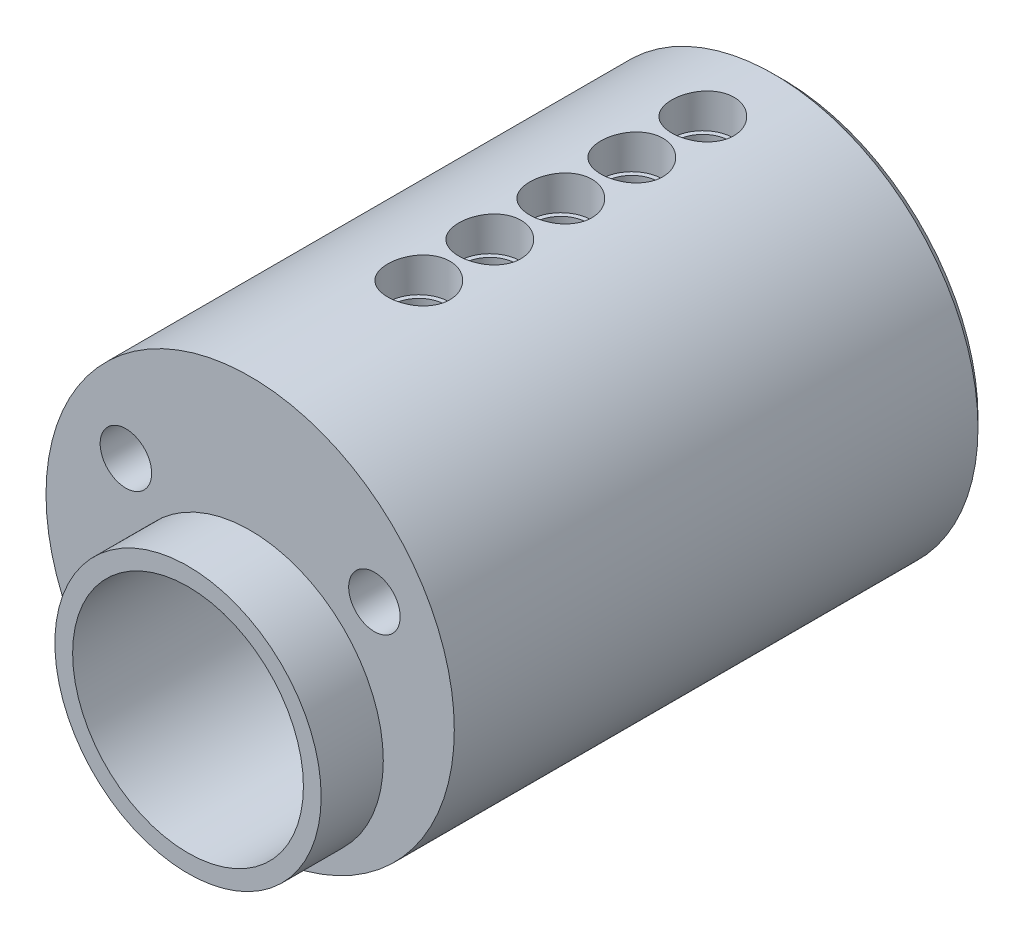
SolidWorks part; units mm, degrees
ref_plane "Plan de face" through (0, 0, 0) normal (0, 0, 1) x (1, 0, 0)
ref_plane "Plan de dessus" through (0, 0, 0) normal (0, 1, 0) x (1, 0, 0)
ref_plane "Plan de droite" through (0, 0, 0) normal (1, 0, 0) x (0, 0, -1)
sketch "Esquisse1" plane through (0, 0, 0) normal (0, 0, 1) x (1, 0, 0)
  circle A0 centre (0, 0) radius 11.5
  dimension "D1" = 23
extrude "Boss.-Extru.1" add sketch "Esquisse1" along normal blind 30
sketch "Esquisse2" plane through (0, 0, 0) normal (0, 0, -1) x (-1, 0, 0)
  line L0 (0, 0) -> (0, -3.5) construction
  circle A0 centre (0, -3.5) radius 6.5
  dimension "D2" = 13
  dimension "D1" = 3.5
extrude "Enlèv. mat.-Extru.1" cut sketch "Esquisse2" against normal through all
sketch "Esquisse3" plane through (0, 0, 0) normal (0, 0, -1) x (-1, 0, 0)
  circle A0 centre (0, -3.5) radius 7
  circle A1 centre (0, -3.5) radius 6.5 construction
  dimension "D1" = 14
extrude "Enlèv. mat.-Extru.2" cut sketch "Esquisse3" against normal blind 1
sketch "Esquisse4" plane through (0, 0, 30) normal (0, 0, 1) x (1, 0, 0)
  circle A0 centre (0, -3.5) radius 6.5 construction
  circle A1 centre (0, -3.5) radius 6.5
  circle A2 centre (0, -3.5) radius 7.5
  dimension "D1" = 15
extrude "Boss.-Extru.2" add sketch "Esquisse4" along normal blind 3.5
ref_plane "Plan1" through (0, 11.5, 0) normal (0, 1, 0) x (-1, 0, 0)
sketch "Esquisse7" plane through (0, 11.5, 0) normal (0, 1, 0) x (-1, 0, 0)
  line L0 (0, 0) -> (0, 26.7957) construction
  circle A0 centre (0, 4.5) radius 1.5
  circle A1 centre (0, 8.5) radius 1.5
  circle A2 centre (0, 12.5) radius 1.5
  circle A3 centre (0, 16.5) radius 1.5
  circle A4 centre (0, 20.5) radius 1.5
  dimension "D1" = 3
  dimension "D2" = 4.5
  dimension "D3" = 4
  dimension "D4" = 4
  dimension "D5" = 4
  dimension "D6" = 4
extrude "Enlèv. mat.-Extru.3" cut sketch "Esquisse7" against normal up to next
sketch "Esquisse8" plane through (0, 11.5, 0) normal (0, 1, 0) x (-1, 0, 0)
  circle A0 centre (0, 20.5) radius 1.75
  circle A1 centre (0, 16.5) radius 1.75
  circle A2 centre (0, 12.5) radius 1.75
  circle A3 centre (0, 8.5) radius 1.75
  circle A4 centre (0, 4.5) radius 1.75
  dimension "D1" = 3.5
extrude "Enlèv. mat.-Extru.4" cut sketch "Esquisse8" against normal blind 2
chamfer "Chanfrein1" distance 0.5 angle 45 1 edges at (11.5, 0, 0)
hole_wizard "Trou taraudé M3.5x0.61" positions "Esquisse10" profile "Esquisse9" tap size "M3.5x0.6" standard "Ansi Métrique"
sketch "Esquisse10" plane through (0, 0, 30) normal (0, 0, 1) x (1, 0, 0)
  line L0 (-7, 4) -> (7, 4) construction
  line L1 (0, 0) -> (0, 4) construction
  circle A1 centre (0, -3.5) radius 6.5 construction
  point P0 (-7, 4)
  point P1 (7, 4)
  point P13 (0, -3.5)
  dimension "D1" = 14
  dimension "D2" = 7.5
sketch "Esquisse9" plane through (-7, 4, 30) normal (1, 0, 0) x (0, -1, 0)
  line L0 (0, 0) -> (0, 10.8712)
  line L1 (0, 10.8712) -> (1.45, 10)
  line L2 (1.45, 10) -> (1.45, 0)
  line L5 (1.45, 0) -> (0, 0)
  line L10 (0, 10.8712) -> (-1.45, 10) construction
  line L11 (0, -6.35) -> (0, 107.95) construction
  dimension "Diamètre du trou pour taraudage" = 2.9
  dimension "Profondeur du trou pour taraudage" = 10
  dimension "Angle de pointe" = 118
sketch "Esquisse14" plane through (-8.1637, -2.2614, 0) normal (0, 0, -1) x (-1, 0, 0)
  line L0 (-2.9375, 5.4885) -> (-1.4063, 7.0198)
  line L1 (-8.1637, 2.2614) -> (-14.7844, 10.1516) construction
  line L2 (-8.1637, 2.2614) -> (-8.1637, 11.5) construction
  line L4 (-13.3899, 5.4885) -> (-14.9212, 7.0198)
  line L5 (-13.5667, 5.3117) -> (-15.0979, 6.843)
  line L6 (-2.7607, 5.3117) -> (-1.2295, 6.843)
  arc A0 (-1.543, 10.1516) -> (-14.7844, 10.1516) centre (-8.1637, 2.2614) ccw
  arc A3 (-4.1641, 5.3411) -> (-12.1634, 5.3411) centre (-8.1637, -1.2386) ccw
  arc A5 (-13.3899, 5.4885) -> (-12.1634, 5.3411) centre (-12.6828, 6.1956) ccw
  arc A6 (-14.7844, 10.1516) -> (-14.9212, 7.0198) centre (-13.4179, 8.523) ccw
  arc A7 (-2.9375, 5.4885) -> (-4.1641, 5.3411) centre (-3.6446, 6.1956) cw
  arc A8 (-1.543, 10.1516) -> (-1.4063, 7.0198) centre (-2.9096, 8.523) cw
  arc A9 (-1.3823, 10.3432) -> (-14.9451, 10.3432) centre (-8.1637, 2.2614) ccw
  arc A10 (-14.9451, 10.3432) -> (-15.0979, 6.843) centre (-13.4179, 8.523) ccw
  arc A11 (-13.5667, 5.3117) -> (-12.0335, 5.1275) centre (-12.6828, 6.1956) ccw
  arc A12 (-4.2939, 5.1275) -> (-12.0335, 5.1275) centre (-8.1637, -1.2386) ccw
  arc A13 (-2.7607, 5.3117) -> (-4.2939, 5.1275) centre (-3.6446, 6.1956) cw
  arc A14 (-1.3823, 10.3432) -> (-1.2295, 6.843) centre (-2.9096, 8.523) cw
  circle A15 centre (-8.1637, 2.2614) radius 11.5 construction
  circle A16 centre (-8.1637, 2.2614) radius 11 construction
  circle A17 centre (-8.1637, -1.2386) radius 7 construction
  dimension "D1" = 0.45
  dimension "D2" = 0.45
  dimension "D5" = 2.126
  dimension "D6" = 1
  dimension "D3" = 45
  dimension "D4" = 40
  dimension "D7" = 0.25
extrude "Enlèv. mat.-Extru.6" cut sketch "Esquisse14" against normal blind 0.01
sketch "Esquisse15" plane through (0, 0, 0) normal (0, 0, -1) x (-1, 0, 0)
  line L0 (-8.7178, 7.5) -> (8.7178, 7.5) construction
  line L1 (0, 11.5) -> (0, 3.5) construction
  line L3 (-10.583, 4.5) -> (10.583, 4.5) construction
  circle A1 centre (0, -3.5) radius 7 construction
  circle A2 centre (0, 0) radius 11.5 construction
  text T0 "style" font "Century Gothic" height 2
  text T1 "\"THIRARD\"" font "Century Gothic" height 2
  point P11 (0, 7.5)
  dimension "D1" = 3
extrude "Enlèv. mat.-Extru.7" cut sketch "Esquisse15" against normal blind 0.01
